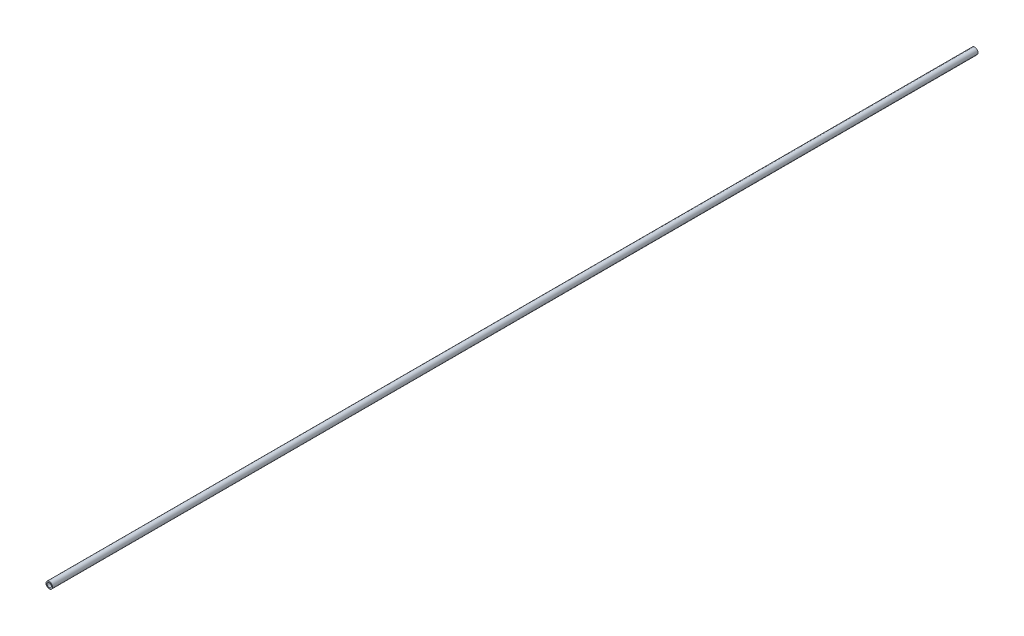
SolidWorks part; units mm, degrees
ref_plane "Front" through (0, 0, 0) normal (0, 0, 1) x (1, 0, 0)
ref_plane "Top" through (0, 0, 0) normal (0, 1, 0) x (1, 0, 0)
ref_plane "Side" through (0, 0, 0) normal (1, 0, 0) x (0, 0, -1)
sketch "PipeSketch" plane through (0, 0, 0) normal (0, 0, 1) x (1, 0, 0)
  circle A0 centre (0, 0) radius 10.668
  circle A1 centre (0, 0) radius 6.9342
  dimension "OuterDiameter" = 21.336
  dimension "InnerDiameter" = 13.8684
extrude "Extrusion" add sketch "PipeSketch" along normal blind 3048
sketch "FilterSketch" plane through (0, 0, 0) normal (0, 0, 1) x (1, 0, 0)
  circle A0 centre (0, 0) radius 6.35 construction
  dimension "NominalDiameter" = 12.7
